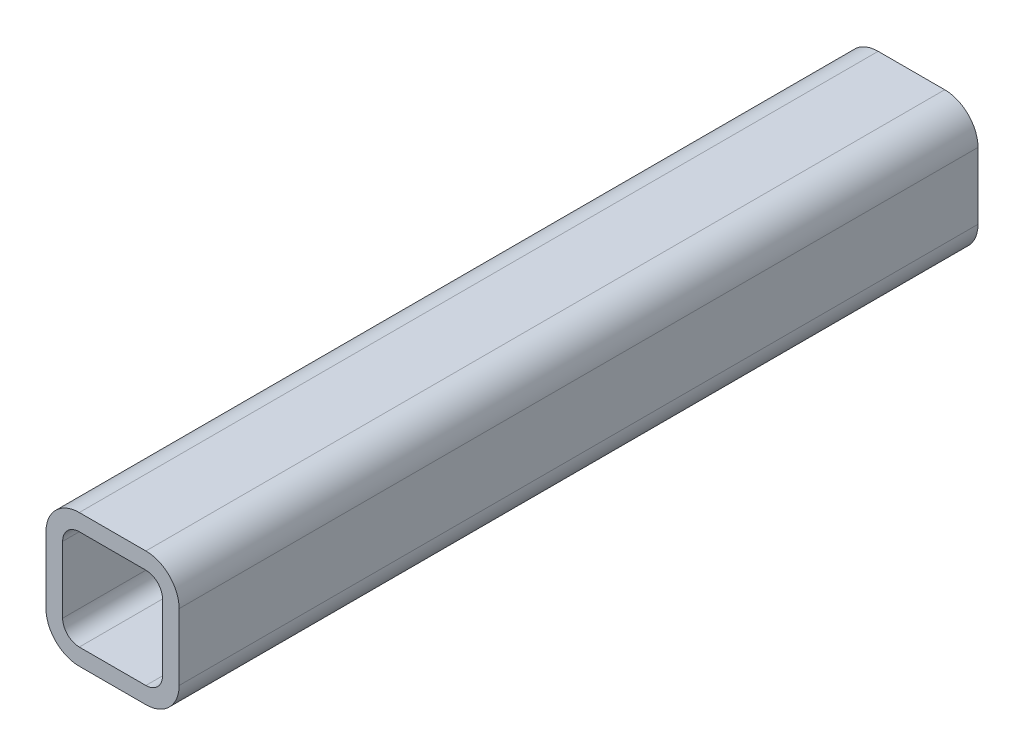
SolidWorks part; units mm, degrees
ref_plane "Front Plane" through (0, 0, 0) normal (0, 0, 1) x (1, 0, 0)
ref_plane "Top Plane" through (0, 0, 0) normal (0, 1, 0) x (1, 0, 0)
ref_plane "Right Plane" through (0, 0, 0) normal (1, 0, 0) x (0, 0, -1)
sketch "Sketch1" plane through (0, 0, 0) normal (0, 0, 1) x (1, 0, 0)
  point P0 (0, 0)
  line B0 (-1.2779, 35.3751) -> (-1.2779, 9.9751)
  line B1 (5.0721, 9.9751) -> (5.0721, 35.3751)
  line B2 (36.8221, 48.0751) -> (11.4221, 48.0751)
  arc B3 (49.5221, 35.3751) -> (36.8221, 48.0751) centre (36.8221, 35.3751) ccw
  line B4 (49.5221, 9.9751) -> (49.5221, 35.3751)
  arc B5 (36.8221, -2.7249) -> (49.5221, 9.9751) centre (36.8221, 9.9751) ccw
  line B6 (11.4221, -2.7249) -> (36.8221, -2.7249)
  arc B7 (-1.2779, 9.9751) -> (11.4221, -2.7249) centre (11.4221, 9.9751) ccw
  arc B8 (11.4221, 48.0751) -> (-1.2779, 35.3751) centre (11.4221, 35.3751) ccw
  line B9 (11.4221, 41.7251) -> (36.8221, 41.7251)
  arc B10 (43.1721, 35.3751) -> (36.8221, 41.7251) centre (36.8221, 35.3751) ccw
  line B11 (43.1721, 35.3751) -> (43.1721, 9.9751)
  arc B12 (36.8221, 3.6251) -> (43.1721, 9.9751) centre (36.8221, 9.9751) ccw
  line B13 (36.8221, 3.6251) -> (11.4221, 3.6251)
  arc B14 (5.0721, 9.9751) -> (11.4221, 3.6251) centre (11.4221, 9.9751) ccw
  arc B15 (11.4221, 41.7251) -> (5.0721, 35.3751) centre (11.4221, 35.3751) ccw
sketch_block_instance "HSS2x2x0.250-1"
sketch_block "HSS2x2x0.250"
extrude "Boss-Extrude1" add sketch "Sketch1" along normal blind 304.8
